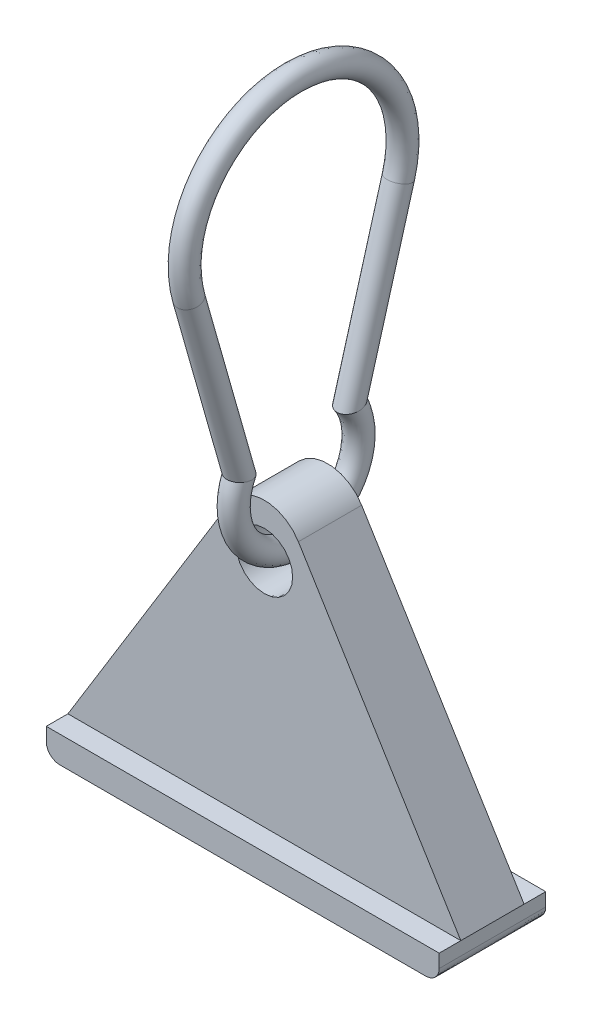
SolidWorks part; units mm, degrees
ref_plane "前视基准面" through (0, 0, 0) normal (0, 0, 1) x (1, 0, 0)
ref_plane "上视基准面" through (0, 0, 0) normal (0, 1, 0) x (1, 0, 0)
ref_plane "右视基准面" through (0, 0, 0) normal (1, 0, 0) x (0, 0, -1)
sketch "草图1" plane through (0, 0, 0) normal (0, 0, 1) x (1, 0, 0)
  line L1 (0, 0) -> (0, 58.742) construction
  line L2 (-29.5, 0) -> (0, 48)
  line L3 (0, 48) -> (29.5, 0)
  line L4 (-29.5, 0) -> (-29.5, -4)
  line L5 (-29.5, -4) -> (29.5, -4)
  line L6 (29.5, -4) -> (29.5, 0)
  dimension "D1" = 59
  dimension "D2" = 48
extrude "凸台-拉伸1" add sketch "草图1" along normal mid plane 16
sketch "草图2" plane through (29.5, 0, 0) normal (1, 0, 0) x (0, 0, -1)
  line L0 (-8, 0) -> (8, 0) construction
  line L1 (-8, 48) -> (-4.75, 48)
  line L2 (-8, 48) -> (-8, 0)
  line L3 (-8, 0) -> (-4.75, 0)
  line L4 (-4.75, 48) -> (-4.75, 0)
  dimension "D1" = 3.25
extrude "切除-拉伸1" cut sketch "草图2" against normal through all
mirror "镜向1" about plane through (0, 0, 0) normal (0, 0, 1) of "切除-拉伸1"
fillet "圆角1" radius 6 1 edges at (0, 48, 0)
sketch "草图3" plane through (0, 0, 4.75) normal (0, 0, 1) x (1, 0, 0)
  line L0 (5.1118, 39.6825) -> (29.5, 0) construction
  line L1 (-29.5, 0) -> (-5.1118, 39.6825) construction
  circle A0 centre (0, 34.6311) radius 4.25
  dimension "D1" = 7
  dimension "D2" = 7
  dimension "D3" = 8.5
extrude "切除-拉伸2" cut sketch "草图3" against normal blind 16 contours A0
fillet "圆角2" radius 2 2 edges at (29.5, -4, 0) (-29.5, -4, 0)
sketch "草图4" plane through (0, 0, 0) normal (0, 0, 1) x (1, 0, 0)
  circle A0 centre (0, 34.6311) radius 1.75
sketch "草图5" plane through (0, 0, 0) normal (1, 0, 0) x (0, 0, -1)
  line L0 (-14.7936, 74.8924) -> (-7.0715, 47.7024)
  line L1 (14.0652, 74.8924) -> (6.586, 48.5574)
  arc A0 (-7.0715, 47.7024) -> (6.586, 48.5574) centre (0.0162, 43.9924) ccw
  arc A1 (14.0652, 74.8924) -> (-14.7936, 74.8924) centre (-0.3642, 78.9904) ccw
  dimension "D1" = 16
  dimension "D2" = 30
  dimension "D3" = 35
sweep "扫描1" add profiles "草图4" path "草图5"
